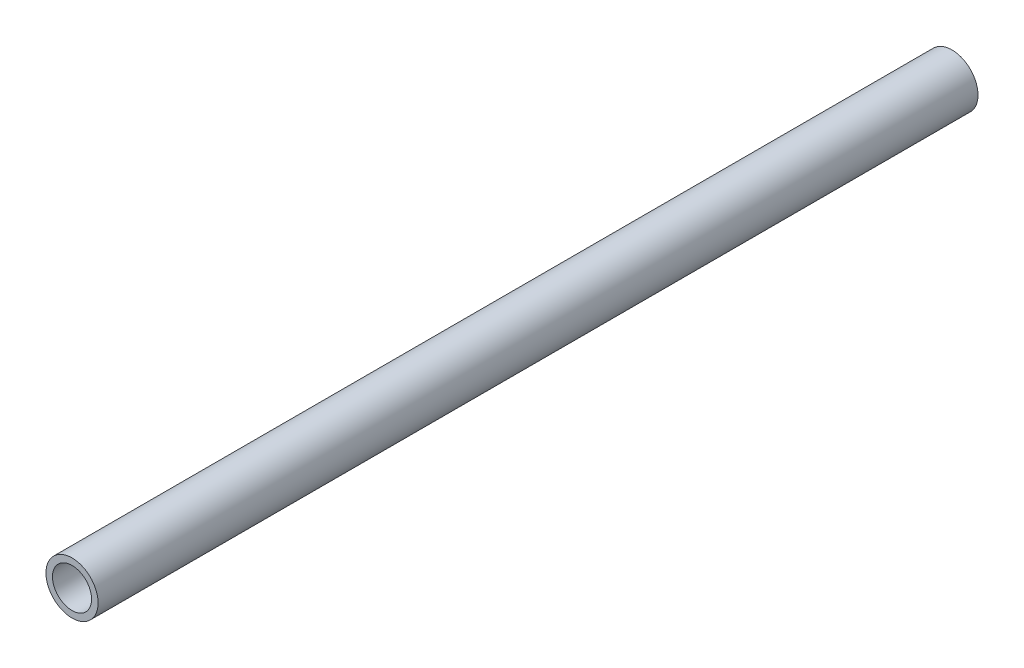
SolidWorks part; units mm, degrees
ref_plane "Plan de face" through (0, 0, 0) normal (0, 0, 1) x (1, 0, 0)
ref_plane "Plan de dessus" through (0, 0, 0) normal (0, 1, 0) x (1, 0, 0)
ref_plane "Plan de droite" through (0, 0, 0) normal (1, 0, 0) x (0, 0, -1)
sketch "Esquisse1" plane through (0, 0, 0) normal (0, 0, 1) x (1, 0, 0)
  circle A0 centre (0, 0) radius 3
  circle A1 centre (0, 0) radius 4
  dimension "D1" = 8
  dimension "D2" = 6
extrude "Extrusion1" add sketch "Esquisse1" against normal blind 135
